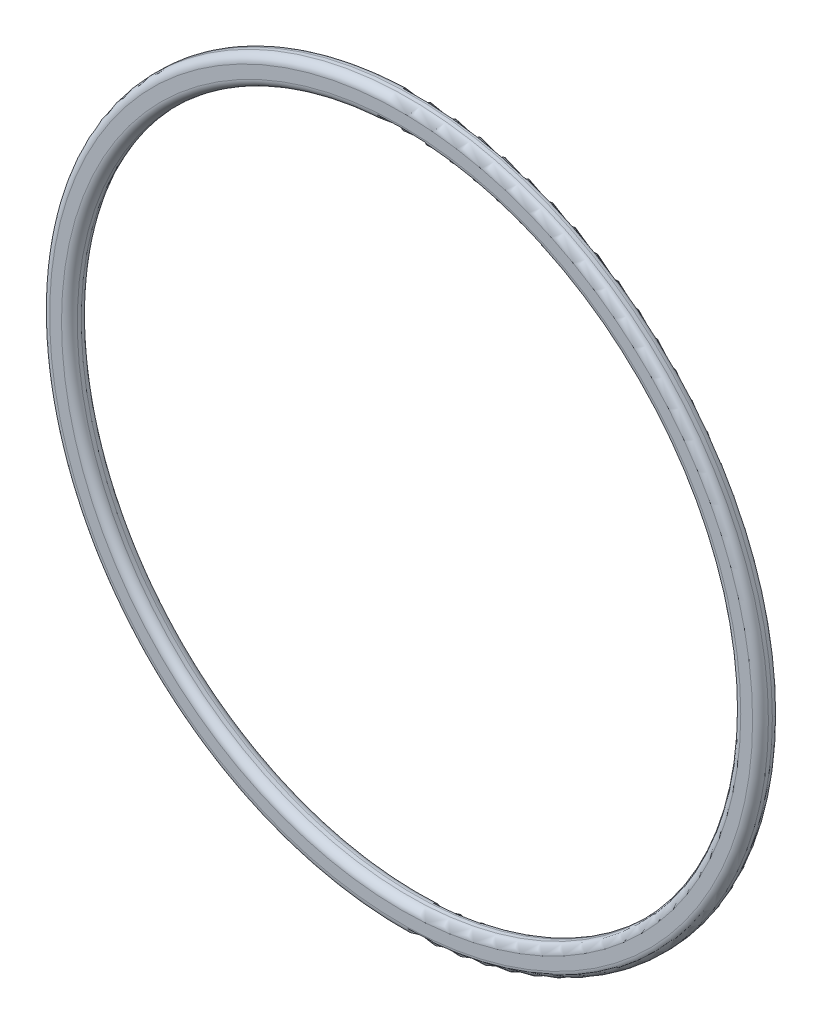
SolidWorks part; units mm, degrees
ref_plane "Plan de face" through (0, 0, 0) normal (0, 0, 1) x (1, 0, 0)
ref_plane "Plan de dessus" through (0, 0, 0) normal (0, 1, 0) x (1, 0, 0)
ref_plane "Plan de droite" through (0, 0, 0) normal (1, 0, 0) x (0, 0, -1)
sketch "Esquisse1" plane through (0, 0, 0) normal (1, 0, 0) x (0, 0, -1)
  line L0 (-20.8244, 0) -> (21.7431, 0) construction
  line L2 (1.4594, 45.5) -> (1.9594, 45.5)
  line L3 (0.4594, 44.5) -> (0.4594, 43)
  line L4 (1.4594, 42) -> (1.9594, 42)
  line L5 (2.9594, 44.5) -> (2.9594, 43)
  arc A0 (1.9594, 42) -> (2.9594, 43) centre (1.9594, 43) ccw
  arc A1 (1.9594, 45.5) -> (2.9594, 44.5) centre (1.9594, 44.5) cw
  arc A2 (1.4594, 45.5) -> (0.4594, 44.5) centre (1.4594, 44.5) ccw
  arc A3 (0.4594, 43) -> (1.4594, 42) centre (1.4594, 43) ccw
  dimension "D4" = 1
  dimension "D1" = 84
  dimension "D2" = 91
  dimension "D3" = 2.5
revolve "Révolution1" add sketch "Esquisse1" angle 360 about L0
